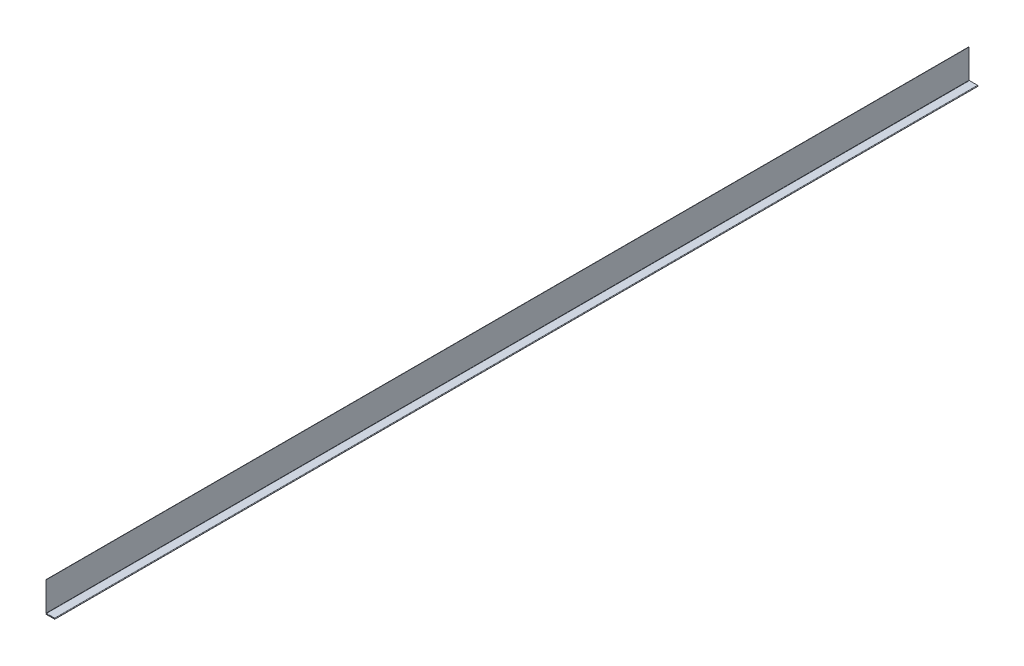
SolidWorks part; units mm, degrees
ref_plane "Front" through (0, 0, 0) normal (0, 0, 1) x (1, 0, 0)
ref_plane "Top" through (0, 0, 0) normal (0, 1, 0) x (1, 0, 0)
ref_plane "Right" through (0, 0, 0) normal (1, 0, 0) x (0, 0, -1)
sketch "Sketch1" plane through (0, 0, 0) normal (0, 0, 1) x (1, 0, 0)
  line L0 (0, 1) -> (0, 63.5)
  line L1 (1, 0) -> (18.542, 0)
  line L2 (19.05, 0) -> (19.05, -1.756) construction
  line L3 (18.542, -1.016) -> (0, -1.016)
  arc A0 (18.542, -1.016) -> (18.542, 0) centre (18.542, -0.508) ccw
  arc A3 (0, 1) -> (1, 0) centre (1, 1) ccw
  point P18 (0, 0)
  dimension "D2" = 1.016
  dimension "D1" = 63.5
  dimension "D7" = 19.05
extrude "Extrude-Thin1" add sketch "Sketch1" along normal blind 2000 thin
